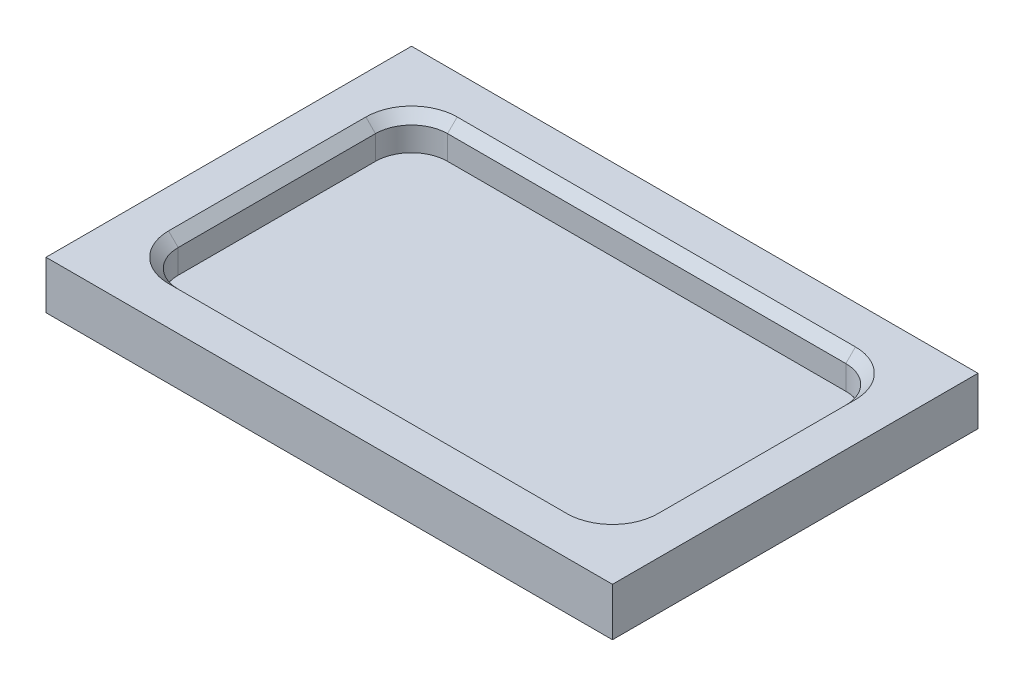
SolidWorks part; units mm, degrees
ref_plane "Front Plane" through (0, 0, 0) normal (0, 0, 1) x (1, 0, 0)
ref_plane "Top Plane" through (0, 0, 0) normal (0, 1, 0) x (1, 0, 0)
ref_plane "Right Plane" through (0, 0, 0) normal (1, 0, 0) x (0, 0, -1)
sketch "Sketch1" plane through (0, 0, 0) normal (0, 1, 0) x (1, 0, 0)
  line L1 (-62.7141, 44.4034) -> (86.9758, 44.4034)
  line L2 (-62.7141, 44.4034) -> (-62.7141, -52.1855)
  line L3 (-62.7141, -52.1855) -> (86.9758, -52.1855)
  line L4 (86.9758, 44.4034) -> (86.9758, -52.1855)
extrude "Extrude1" add sketch "Sketch1" along normal blind 12.7
sketch "Sketch2" plane through (0, 12.7, 0) normal (0, 1, 0) x (-1, 0, 0)
  line L0 (-86.9758, -44.4034) -> (62.7141, -44.4034) construction
  line L1 (50.0141, -31.7034) -> (-74.2758, -31.7034)
  line L2 (50.0141, -31.7034) -> (50.0141, 39.4855)
  line L3 (50.0141, 39.4855) -> (-74.2758, 39.4855)
  line L4 (-74.2758, -31.7034) -> (-74.2758, 39.4855)
  line L5 (62.7141, 52.1855) -> (-86.9758, 52.1855) construction
  line L6 (-86.9758, 52.1855) -> (-86.9758, -44.4034) construction
  line L7 (62.7141, -44.4034) -> (62.7141, 52.1855) construction
  point P8 (-86.9758, 3.891)
  dimension "D1" = 12.7
  dimension "D2" = 12.7
  dimension "D3" = 12.7
  dimension "D4" = 12.7
extrude "Cut-Extrude1" cut sketch "Sketch2" against normal blind 8.89
fillet "Fillet1" radius 9.525 4 edges at (-50.0141, 8.255, 39.4855) (-50.0141, 8.255, -31.7034) (74.2758, 8.255, -31.7034) (74.2758, 8.255, 39.4855)
chamfer "Chamfer1" distance 2.54 angle 45 8 edges at (12.1308, 12.7, -31.7034) (74.2758, 12.7, 3.891) (12.1308, 12.7, 39.4855) (-50.0141, 12.7, 3.891) (71.486, 12.7, -28.9136) (71.486, 12.7, 36.6957) (-47.2243, 12.7, 36.6957) (-47.2243, 12.7, -28.9136)
